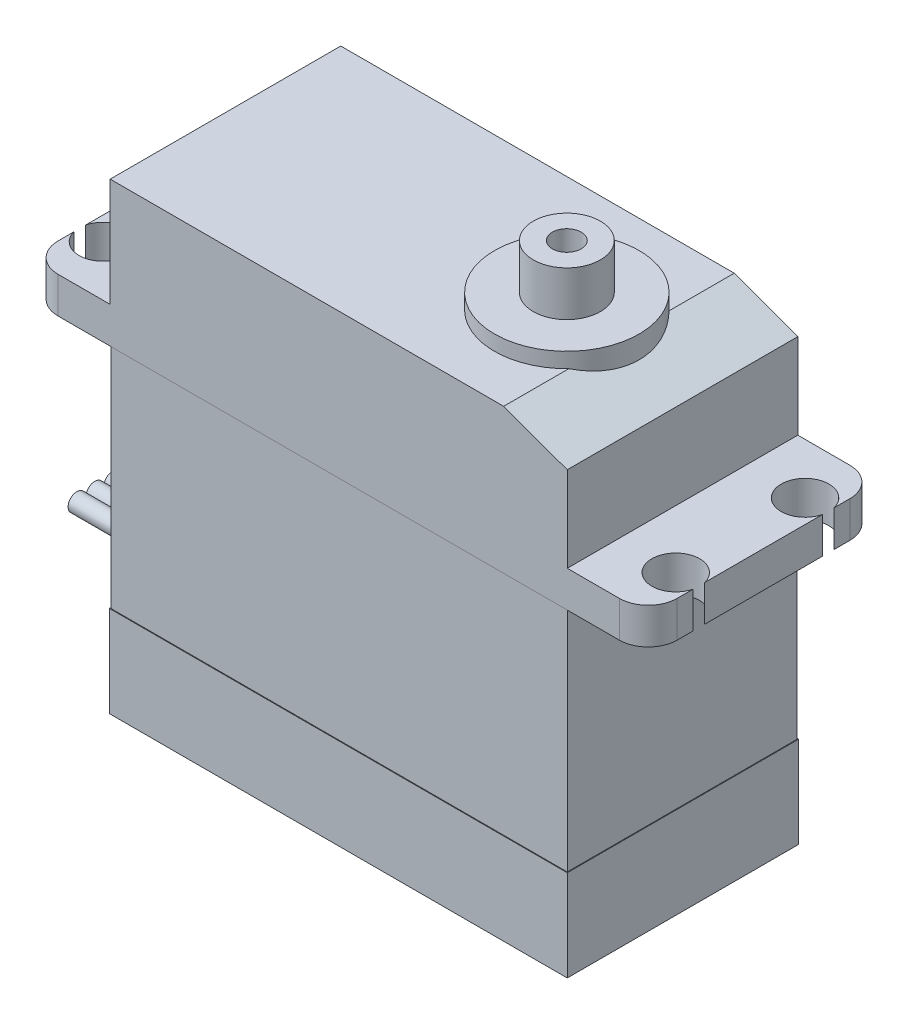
SolidWorks part; units mm, degrees
ref_plane "Front Plane" through (0, 0, 0) normal (0, 0, 1) x (1, 0, 0)
ref_plane "Top Plane" through (0, 0, 0) normal (0, 1, 0) x (1, 0, 0)
ref_plane "Right Plane" through (0, 0, 0) normal (1, 0, 0) x (0, 0, -1)
sketch "Sketch1" plane through (0, 0, 0) normal (0, 1, 0) x (1, 0, 0)
  line L1 (20.0406, 10.0965) -> (-20.0406, 10.0965)
  line L2 (20.0406, 10.0965) -> (20.0406, -10.0965)
  line L3 (20.0406, -10.0965) -> (-20.0406, -10.0965)
  line L4 (-20.0406, 10.0965) -> (-20.0406, -10.0965)
  line L5 (20.0406, 10.0965) -> (-20.0406, -10.0965) construction
  line L6 (20.0406, -10.0965) -> (-20.0406, 10.0965) construction
  point P0 (0, 0)
  dimension "D1" = 40.0812
  dimension "D2" = 20.193
extrude "Boss-Extrude1" add sketch "Sketch1" along normal blind 40.64
sketch "Sketch2" plane through (0, 0, 0) normal (0, -1, 0) x (1, 0, 0)
  line L0 (-20.0406, -10.0965) -> (-20.0406, 10.0965) construction
  line L1 (20.1041, -10.16) -> (-20.1041, -10.16)
  line L2 (20.1041, -10.16) -> (20.1041, 10.16)
  line L3 (20.1041, 10.16) -> (-20.1041, 10.16)
  line L4 (-20.1041, -10.16) -> (-20.1041, 10.16)
  line L5 (20.1041, -10.16) -> (-20.1041, 10.16) construction
  line L6 (20.1041, 10.16) -> (-20.1041, -10.16) construction
  line L7 (-20.0406, 10.0965) -> (20.0406, 10.0965) construction
  point P0 (0, 0)
  dimension "D1" = 0.0635
  dimension "D2" = 0.0635
extrude "Boss-Extrude2" add sketch "Sketch2" against normal blind 8.001
sketch "Sketch3" plane through (0, 40.64, 0) normal (0, 1, 0) x (1, 0, 0)
  line L0 (-20.0406, 10.0965) -> (-20.0406, -10.0965) construction
  line L1 (20.066, -10.1219) -> (-20.066, -10.1219)
  line L2 (20.066, -10.1219) -> (20.066, 10.1219)
  line L3 (20.066, 10.1219) -> (-20.066, 10.1219)
  line L4 (-20.066, -10.1219) -> (-20.066, 10.1219)
  line L5 (20.066, -10.1219) -> (-20.066, 10.1219) construction
  line L6 (20.066, 10.1219) -> (-20.066, -10.1219) construction
  line L7 (20.0406, 10.0965) -> (-20.0406, 10.0965) construction
  point P0 (0, 0)
  dimension "D1" = 0.0254
  dimension "D2" = 0.0254
extrude "Boss-Extrude3" add sketch "Sketch3" against normal blind 12.7
sketch "Sketch4" plane through (20.066, 0, 0) normal (1, 0, 0) x (0, 0, -1)
  line L0 (10.1219, 27.94) -> (10.1219, 40.64) construction
  line L1 (-10.1219, 27.94) -> (10.1219, 27.94)
  line L2 (-10.1219, 27.94) -> (-10.1219, 31.115)
  line L3 (-10.1219, 31.115) -> (10.1219, 31.115)
  line L4 (10.1219, 27.94) -> (10.1219, 31.115)
  line L5 (-10.1219, 27.94) -> (-10.1219, 40.64) construction
  line L6 (-10.1219, 27.94) -> (10.1219, 27.94) construction
  dimension "D1" = 3.175
extrude "Boss-Extrude4" add sketch "Sketch4" along normal blind 7.112
sketch "Sketch5" plane through (0, 31.115, 0) normal (0, 1, 0) x (1, 0, 0)
  line L1 (20.066, 10.1219) -> (20.066, -10.1219) construction
  line L2 (27.178, 10.1219) -> (20.066, 10.1219) construction
  line L3 (27.178, -10.1219) -> (20.066, -10.1219) construction
  circle A0 centre (25.146, 5.6769) radius 2.0955
  circle A1 centre (25.146, -5.6769) radius 2.0955
  dimension "D1" = 4.191
  dimension "D2" = 5.08
  dimension "D3" = 4.445
  dimension "D4" = 4.445
extrude "Cut-Extrude1" cut sketch "Sketch5" against normal up to surface (3.175 mm away)
fillet "Fillet1" radius 2.54 2 edges at (27.178, 29.5275, -10.1219) (27.178, 29.5275, 10.1219)
mirror "Mirror1" about plane through (0, 0, 0) normal (1, 0, 0) of "Fillet1", "Cut-Extrude1", "Boss-Extrude4"
sketch "Sketch6" plane through (-20.1041, 0, 0) normal (-1, 0, 0) x (0, 0, 1)
  line L0 (10.0965, 8.001) -> (-10.0965, 8.001) construction
  line L1 (3.302, 8.001) -> (-3.302, 8.001)
  line L2 (3.302, 8.001) -> (3.302, 4.191)
  line L3 (3.302, 4.191) -> (-3.302, 4.191)
  line L4 (-3.302, 8.001) -> (-3.302, 4.191)
  line L5 (3.302, 8.001) -> (-3.302, 4.191) construction
  line L6 (3.302, 4.191) -> (-3.302, 8.001) construction
  point P0 (0, 6.096)
  dimension "D1" = 6.604
  dimension "D2" = 3.81
extrude "Boss-Extrude5" add sketch "Sketch6" along normal blind 5.715
sketch "Sketch7" plane through (-25.8191, 0, 0) normal (-1, 0, 0) x (0, 0, 1)
  line L0 (-3.302, 8.001) -> (-3.302, 4.191) construction
  circle A0 centre (-1.5748, 6.096) radius 0.7747
  circle A1 centre (0, 6.096) radius 0.7747
  circle A2 centre (1.5748, 6.096) radius 0.7747
  point P4 (-3.302, 6.096)
  dimension "D1" = 1.5494
  dimension "D2" = 1.5748
  dimension "D3" = 1.5748
extrude "Boss-Extrude9" add sketch "Sketch7" along normal blind 5.715
sketch "Sketch8" plane through (0, 40.64, 0) normal (0, 1, 0) x (1, 0, 0)
  line L0 (20.066, 10.1219) -> (20.066, -10.1219) construction
  circle A0 centre (9.906, 0) radius 6.35
  dimension "D1" = 12.7
  dimension "D2" = 10.16
extrude "Boss-Extrude10" add sketch "Sketch8" along normal blind 1.3208
sketch "Sketch9" plane through (0, 41.9608, 0) normal (0, 1, 0) x (1, 0, 0)
  circle A0 centre (9.906, 0) radius 2.9464
  dimension "D1" = 5.8928
extrude "Boss-Extrude11" add sketch "Sketch9" along normal blind 3.937
chamfer "Chamfer1" distance 2.032 angle 70 1 edges at (20.066, 40.64, 0)
sketch "Sketch10" plane through (0, 45.8978, 0) normal (0, 1, 0) x (1, 0, 0)
  circle A0 centre (9.906, 0) radius 1.27
  dimension "D1" = 2.54
extrude "Cut-Extrude2" cut sketch "Sketch10" against normal blind 7.62
